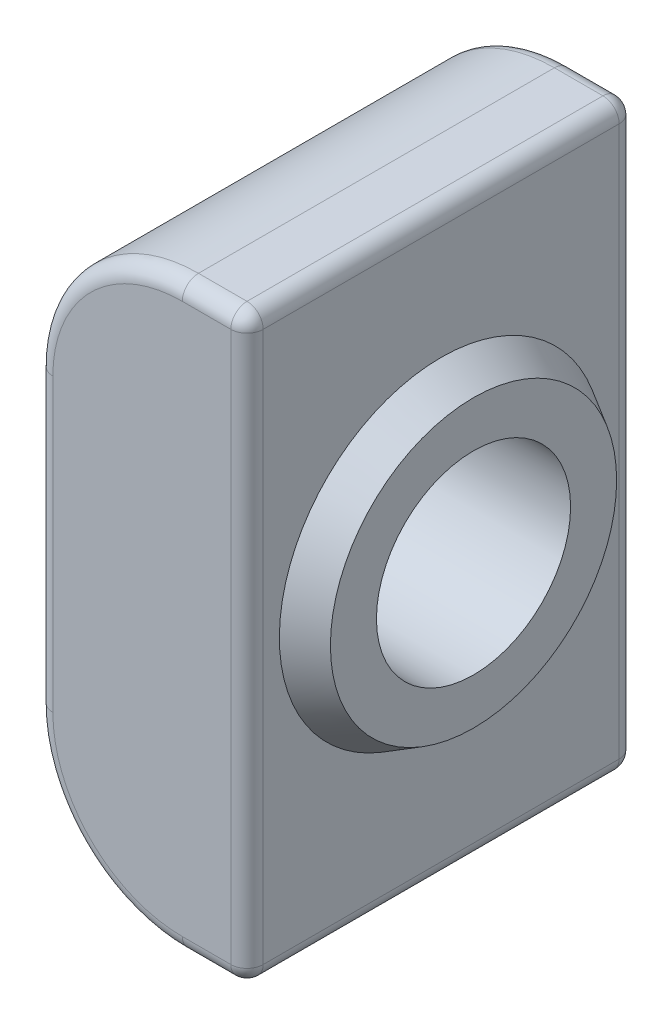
SolidWorks part; units mm, degrees
ref_plane "Plan de face" through (0, 0, 0) normal (0, 0, 1) x (1, 0, 0)
ref_plane "Plan de dessus" through (0, 0, 0) normal (0, 1, 0) x (1, 0, 0)
ref_plane "Plan de droite" through (0, 0, 0) normal (1, 0, 0) x (0, 0, -1)
sketch "Esquisse1" plane through (0, 0, 0) normal (0, 0, 1) x (1, 0, 0)
  line L1 (0, 9) -> (-2, 9)
  line L2 (0, 9) -> (0, -9)
  line L3 (0, -9) -> (-2, -9)
  line L4 (-6.5, 4.5) -> (-6.5, -4.5)
  arc A0 (-2, -9) -> (-6.5, -4.5) centre (-2, -4.5) cw
  arc A1 (-2, 9) -> (-6.5, 4.5) centre (-2, 4.5) ccw
  point P9 (-6.5, 9)
  dimension "D3" = 4.5
  dimension "D1" = 18
  dimension "D2" = 6.5
extrude "Boss.-Extru.1" add sketch "Esquisse1" along normal mid plane 12
sketch "Esquisse2" plane through (0, 0, 0) normal (1, 0, 0) x (0, 0, -1)
  circle A0 centre (0, 0) radius 5
  dimension "D1" = 10
extrude "Boss.-Extru.2" add sketch "Esquisse2" along normal blind 1 draft 30
sketch "Esquisse3" plane through (1, 0, 0) normal (1, 0, 0) x (0, 0, -1)
  circle A0 centre (0, 0) radius 3
  dimension "D1" = 6
extrude "Enlèv. mat.-Extru.1" cut sketch "Esquisse3" against normal through all
fillet "Congé1" radius 0.5 14 edges at (-1, 9, -6) (-5.182, 7.682, -6) (-6.5, 0, -6) (-5.182, -7.682, -6) (-1, -9, -6) (0, 0, -6) (-1, -9, 6) (-5.182, -7.682, 6) (-6.5, 0, 6) (-5.182, 7.682, 6) (-1, 9, 6) (0, 0, 6) (0, -9, 0) (0, 9, 0)
